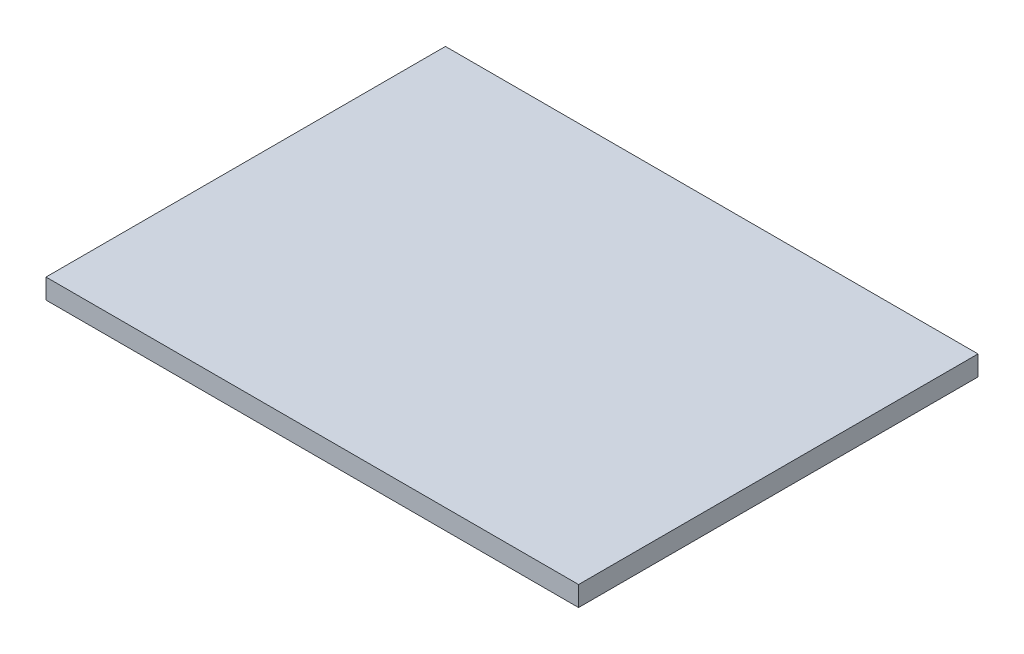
SolidWorks part; units mm, degrees
ref_plane "Front" through (0, 0, 0) normal (0, 0, 1) x (1, 0, 0)
ref_plane "Top" through (0, 0, 0) normal (0, 1, 0) x (1, 0, 0)
ref_plane "Right" through (0, 0, 0) normal (1, 0, 0) x (0, 0, -1)
sketch "Sketch1" plane through (0, 0, 0) normal (0, 1, 0) x (1, 0, 0)
  line L1 (-200, 150) -> (200, 150)
  line L2 (-200, 150) -> (-200, -150)
  line L3 (-200, -150) -> (200, -150)
  line L4 (200, 150) -> (200, -150)
  line L5 (-200, 150) -> (200, -150) construction
  line L6 (-200, -150) -> (200, 150) construction
  point P0 (0, 0)
  dimension "D1" = 300
  dimension "D2" = 400
extrude "Boss-Extrude2" add sketch "Sketch1" along normal blind 15
